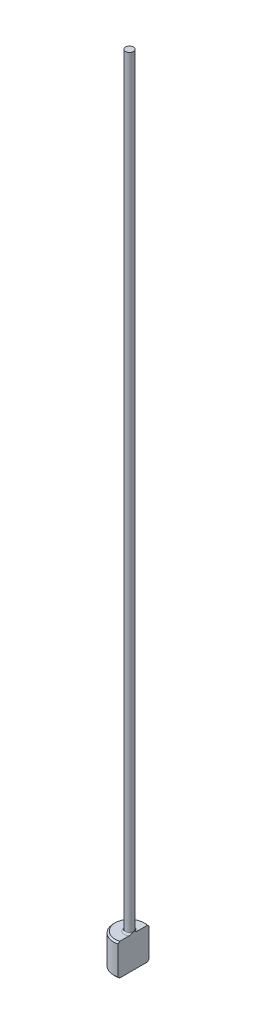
SolidWorks part; units mm, degrees
ref_plane "Front Plane" through (0, 0, 0) normal (0, 0, 1) x (1, 0, 0)
ref_plane "Top Plane" through (0, 0, 0) normal (0, 1, 0) x (1, 0, 0)
ref_plane "Right Plane" through (0, 0, 0) normal (1, 0, 0) x (0, 0, -1)
sketch "Sketch1" plane through (0, 0, 0) normal (0, 0, 1) x (1, 0, 0)
  line L0 (0, 259.9588) -> (0, -15.1925) construction
  line L1 (0, 0) -> (-2, 0)
  line L2 (-2, 0) -> (-2, 4)
  line L3 (-2, 4) -> (-0.5, 4)
  line L4 (-0.5, 4) -> (-0.5, 100)
  line L5 (-0.5, 100) -> (0, 100)
  line L6 (0, 100) -> (0, 0)
  dimension "L" = 100
  dimension "H" = 4
  dimension "T" = 4
  dimension "D" = 1
revolve "Revolve1" add sketch "Sketch1" angle 360 about L0
chamfer "Chamfer1" distance 0.2 angle 45 2 edges at (0, 4, 2) (0, 0, 2)
fillet "Fillet1" radius 0.2 1 edges at (0, 4, 0.5)
sketch "Sketch2" plane through (0, 0, 0) normal (0, 1, 0) x (1, 0, 0)
  line L0 (0.5, -1.9365) -> (0.5, 1.9365)
  circle A0 centre (0, 0) radius 2 construction
  arc A1 (0.5, -1.9365) -> (0.5, 1.9365) centre (0, 0) ccw
  circle A2 centre (0, 0) radius 0.5 construction
extrude "KEYED HEAD" cut sketch "Sketch2" along normal through all
